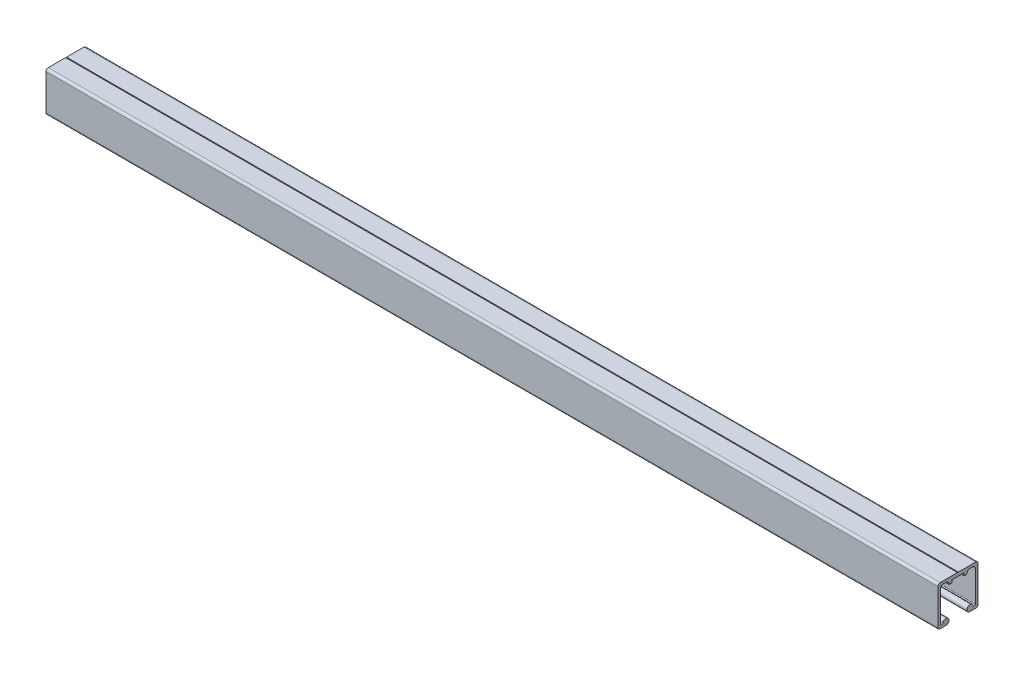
SolidWorks part; units mm, degrees
ref_plane "Front Plane" through (0, 0, 0) normal (0, 0, 1) x (1, 0, 0)
ref_plane "Top Plane" through (0, 0, 0) normal (0, 1, 0) x (1, 0, 0)
ref_plane "Right Plane" through (0, 0, 0) normal (1, 0, 0) x (0, 0, -1)
sketch "Sketch1" plane through (0, 0, 0) normal (0, 0, 1) x (1, 0, 0)
  line L0 (0, 0) -> (1000, 0)
  dimension "D1" = 1000
other "45-sarja 1.0055 LIUKUOVIPROFIILI(1)"
ref_plane "Plane1" through (0, 0, 0) normal (1, 0, 0) x (0, 0, -1)
sketch "Sketch118" plane through (0, 0, 0) normal (1, 0, 0) x (0, 0, -1)
  line L0 (19.5, 16.5663) -> (19.5, -18.1837)
  line L1 (17.0608, -18.5688) -> (16.8297, -17.8553)
  line L2 (13.5, -22.4337) -> (20, -22.4337)
  line L3 (22.5, -19.9337) -> (22.5, 20.0663)
  line L4 (20, 22.5663) -> (0.5, 22.5663)
  line L5 (0.5, 22.5663) -> (0, 22.0663)
  line L6 (0, 22.0663) -> (-0.5, 22.5663)
  line L7 (-0.5, 22.5663) -> (-20, 22.5663)
  line L8 (-22.5, 20.0663) -> (-22.5, -19.9337)
  line L9 (-20, -22.4337) -> (-13.5, -22.4337)
  line L10 (-16.8297, -17.8553) -> (-17.0608, -18.5688)
  line L11 (-19.5, -18.1837) -> (-19.5, 16.5663)
  line L12 (-16.5, 19.5663) -> (-13.8, 19.5663)
  line L13 (-9.8, 15.5663) -> (-7, 15.5663)
  line L14 (-7, 15.5663) -> (-6.8, 15.7663)
  line L15 (-6.8, 15.7663) -> (-6.8, 18.2663)
  line L16 (-6.5, 18.5663) -> (6.5, 18.5663)
  line L17 (6.8, 18.2663) -> (6.8, 15.7663)
  line L18 (6.8, 15.7663) -> (7, 15.5663)
  line L19 (7, 15.5663) -> (9.8, 15.5663)
  line L20 (13.8, 19.5663) -> (16.5, 19.5663)
  arc A0 (17.0608, -18.5688) -> (19.5, -18.1837) centre (18.25, -18.1837) ccw
  arc A1 (16.8297, -17.8553) -> (13.5, -22.4337) centre (13.5, -18.9337) ccw
  arc A2 (20, -22.4337) -> (22.5, -19.9337) centre (20, -19.9337) ccw
  arc A3 (22.5, 20.0663) -> (20, 22.5663) centre (20, 20.0663) ccw
  arc A4 (-20, 22.5663) -> (-22.5, 20.0663) centre (-20, 20.0663) ccw
  arc A5 (-22.5, -19.9337) -> (-20, -22.4337) centre (-20, -19.9337) ccw
  arc A6 (-13.5, -22.4337) -> (-16.8297, -17.8553) centre (-13.5, -18.9337) ccw
  arc A7 (-19.5, -18.1837) -> (-17.0608, -18.5688) centre (-18.25, -18.1837) ccw
  arc A8 (-16.5, 19.5663) -> (-19.5, 16.5663) centre (-16.5, 16.5663) ccw
  arc A9 (-9.8, 15.5663) -> (-13.8, 19.5663) centre (-13.8, 15.5663) ccw
  arc A10 (-6.5, 18.5663) -> (-6.8, 18.2663) centre (-6.5, 18.2663) ccw
  arc A11 (6.8, 18.2663) -> (6.5, 18.5663) centre (6.5, 18.2663) ccw
  arc A12 (13.8, 19.5663) -> (9.8, 15.5663) centre (13.8, 15.5663) ccw
  arc A13 (19.5, 16.5663) -> (16.5, 19.5663) centre (16.5, 16.5663) ccw
  point P49 (0, 0)
